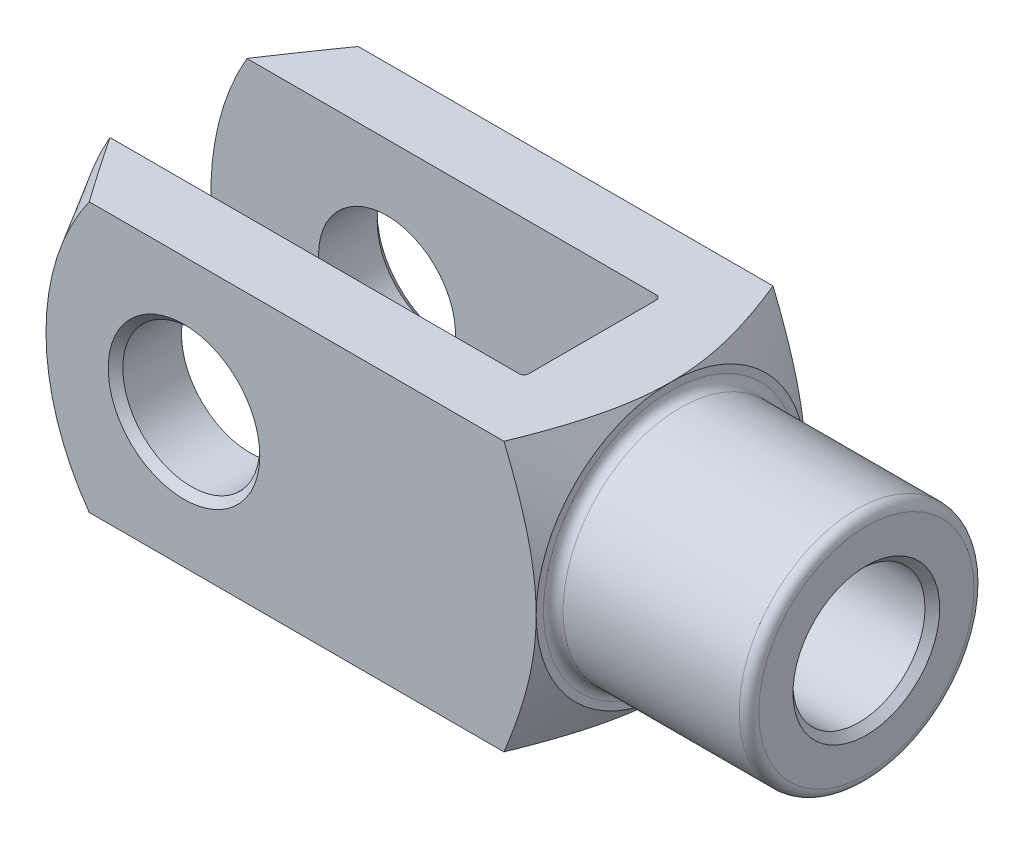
SolidWorks part; units mm, degrees
ref_plane "Front Plane" through (0, 0, 0) normal (0, 0, 1) x (1, 0, 0)
ref_plane "Top Plane" through (0, 0, 0) normal (0, 1, 0) x (1, 0, 0)
ref_plane "Right Plane" through (0, 0, 0) normal (1, 0, 0) x (0, 0, -1)
sketch "Sketch1" plane through (0, 0, 0) normal (1, 0, 0) x (0, 0, -1)
  line L0 (0, 0) -> (0, 50000) construction
  line L1 (0, 0) -> (50000, 0) construction
  line L2 (-27.5, -27.5) -> (-27.5, 27.5)
  line L3 (-27.5, 27.5) -> (27.5, 27.5)
  line L4 (27.5, -27.5) -> (27.5, 27.5)
  line L5 (-27.5, -27.5) -> (27.5, -27.5)
  point P9 (0, 27.5)
  point P11 (27.5, 0)
  point P12 (-27.5, 0)
  dimension "D1" = 55
  dimension "D2" = 55
extrude "Extrude1" add sketch "Sketch1" against normal blind 148
sketch "Sketch2" plane through (0, 0, 0) normal (1, 0, 0) x (0, 0, -1)
  circle A0 centre (0, 0) radius 24
  circle A1 centre (0, 0) radius 48
  dimension "D1" = 48
  dimension "D2" = 96
extrude "Extrude2" cut sketch "Sketch2" against normal blind 40
sketch "Sketch3" plane through (0, 0, 27.5) normal (0, 0, 1) x (1, 0, 0)
  circle A0 centre (-112, 0) radius 14
  dimension "D1" = 28
  dimension "D2" = 112
extrude "Extrude3" cut sketch "Sketch3" against normal through all
sketch "Sketch4" plane through (0, 27.5, 0) normal (0, 1, 0) x (1, 0, 0)
  line L0 (0, 0) -> (-50000, 0) construction
  line L1 (-148, -14) -> (-148, 14)
  line L2 (-148, 27.5) -> (-148, -27.5) construction
  line L3 (-148, 14) -> (-56, 14)
  line L4 (-56, 14) -> (-56, -14)
  line L5 (-112, 27.5) -> (-112, -27.5) construction
  line L6 (-148, -14) -> (-56, -14)
  point P7 (-112, 0)
  point P13 (-56, 0)
  point P14 (-148, 0)
  dimension "D1" = 56
  dimension "D2" = 28
extrude "Extrude4" cut sketch "Sketch4" against normal through all
fillet "Fillet1" radius 1 2 edges at (-56, 0, 14) (-56, 0, -14)
fillet "Fillet2" radius 2 2 edges at (0, 0, -24) (-40, 0, -24)
chamfer "Chamfer2" distance 1.5 angle 45 2 edges at (-98, 0, -27.5) (-98, 0, 27.5)
sketch "Sketch6" plane through (0, 0, 0) normal (0, 0, 1) x (1, 0, 0)
  line L0 (-40, -27.5) -> (-40, -55)
  line L1 (-40, -55) -> (-55.8771, -55)
  line L2 (-55.8771, -55) -> (-40, -27.5)
  dimension "D1" = 30
  dimension "D2" = 55
revolve "Cut-Revolve1" cut sketch "Sketch6" angle 360 about axis through (-40, 0, 0) along (1, 0, 0)
sketch "Sketch7" plane through (0, 0, 0) normal (0, 1, 0) x (1, 0, 0)
  line L0 (-140.2058, -27.5) -> (-148, -14)
  line L1 (-148, 14) -> (-140.2058, 27.5)
  line L2 (-140.2058, 27.5) -> (-203, 27.5)
  line L3 (-148, 14) -> (-148, -14)
  line L4 (-203, 27.5) -> (-203, -27.5)
  line L5 (-203, -27.5) -> (-140.2058, -27.5)
  line L6 (-148, 27.5) -> (-46.5765, 27.5) construction
  line L7 (-148, -27.5) -> (-46.5765, -27.5) construction
  line L8 (-93, 0.6162) -> (-93, 50000.6162) construction
  dimension "D1" = 120
  dimension "D2" = 55
  dimension "D3" = 55
revolve "Cut-Revolve2" cut sketch "Sketch7" angle 180 about L8
sketch "Sketch8" plane through (0, 0, 0) normal (1, 0, 0) x (0, 0, -1)
  circle A0 centre (0, 0) radius 13.5
  dimension "D1" = 27
extrude "Extrude5" cut sketch "Sketch8" against normal through all
chamfer "Chamfer3" distance 1.5 angle 45 1 edges at (0, 0, -13.5)
equation "\"D2@Sketch1\" = \"D1@Sketch1\""
equation "\"D2@Sketch2\" = \"D1@Sketch2\"*2"
equation "\"D2@Sketch6\" = \"D1@Sketch1\""
equation "\"D2@Sketch7\" = \"D1@Sketch1\""
equation "\"D3@Sketch7\" = \"D1@Sketch1\""
